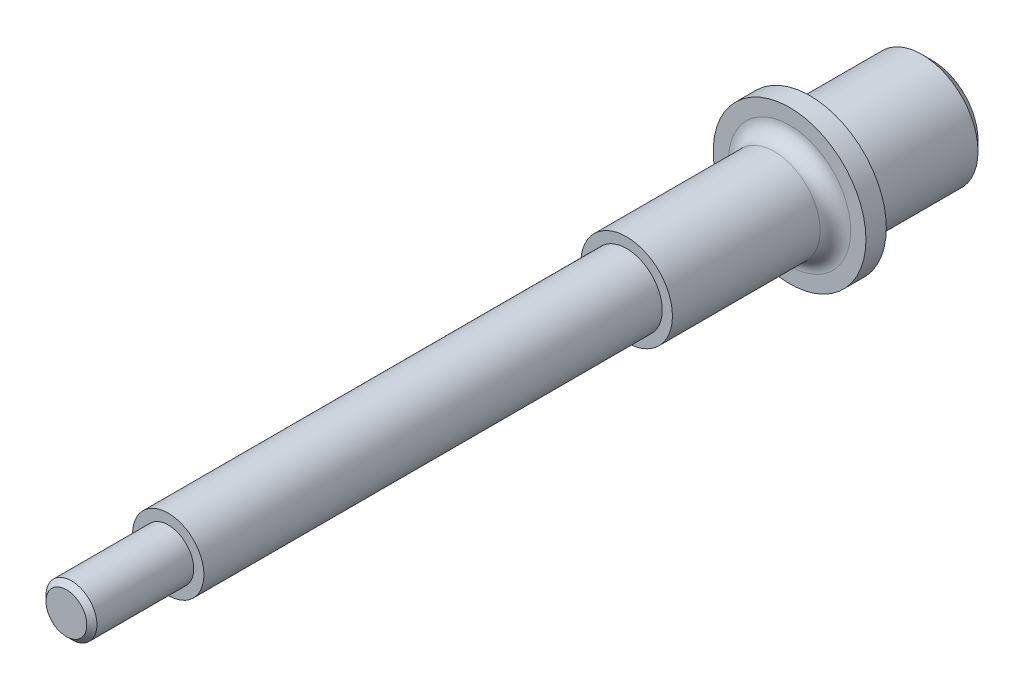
SolidWorks part; units mm, degrees
ref_plane "Plano frontal" through (0, 0, 0) normal (0, 0, 1) x (1, 0, 0)
ref_plane "Plano superior" through (0, 0, 0) normal (0, 1, 0) x (1, 0, 0)
ref_plane "Plano direito" through (0, 0, 0) normal (1, 0, 0) x (0, 0, -1)
sketch "Esboço1" plane through (0, 0, 0) normal (0, 0, 1) x (1, 0, 0)
  circle A0 centre (0, 0) radius 11
  dimension "D1" = 22
extrude "Ressalto-extrusão1" add sketch "Esboço1" along normal blind 24
sketch "Esboço2" plane through (0, 0, 24) normal (0, 0, 1) x (1, 0, 0)
  circle A0 centre (0, 0) radius 15
  dimension "D1" = 30
extrude "Ressalto-extrusão2" add sketch "Esboço2" along normal blind 4
sketch "Esboço3" plane through (0, 0, 28) normal (0, 0, 1) x (1, 0, 0)
  circle A0 centre (0, 0) radius 9
  dimension "D1" = 18
extrude "Ressalto-extrusão3" add sketch "Esboço3" along normal blind 32
sketch "Esboço4" plane through (0, 0, 60) normal (0, 0, 1) x (1, 0, 0)
  circle A0 centre (0, 0) radius 7
  dimension "D1" = 14
extrude "Ressalto-extrusão4" add sketch "Esboço4" along normal blind 90
sketch "Esboço5" plane through (0, 0, 150) normal (0, 0, 1) x (1, 0, 0)
  circle A0 centre (0, 0) radius 5
  dimension "D1" = 10
extrude "Ressalto-extrusão5" add sketch "Esboço5" along normal blind 20
chamfer "Chanfro1" distance 2 angle 45 1 edges at (11, 0, 0)
chamfer "Chanfro2" distance 1 angle 45 1 edges at (5, 0, 170)
fillet "Filete2" radius 3 1 edges at (9, 0, 28)
